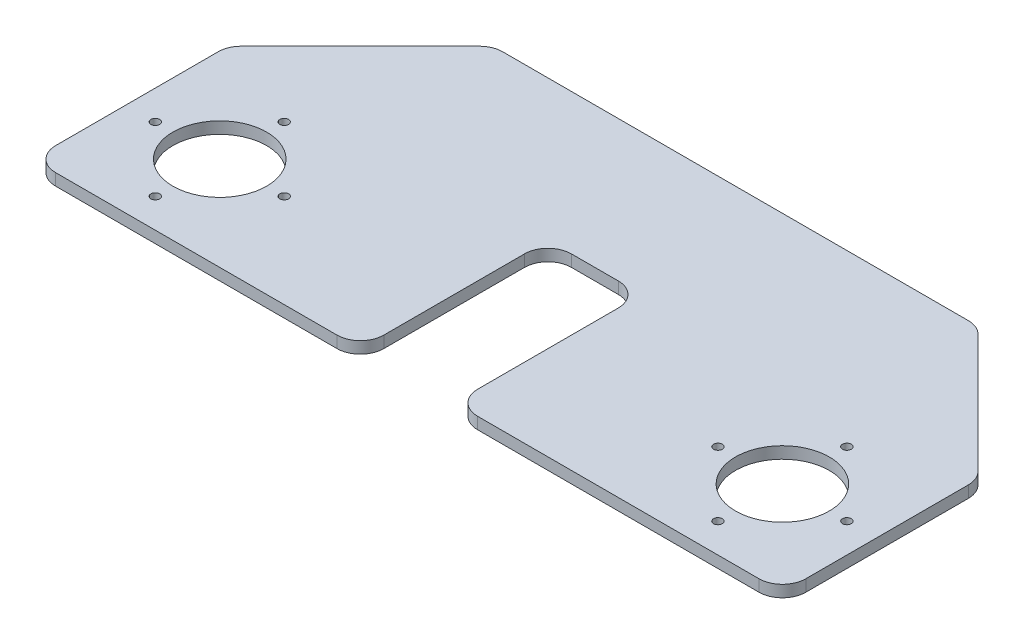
SolidWorks part; units mm, degrees
ref_plane "Front Plane" through (0, 0, 0) normal (0, 0, 1) x (1, 0, 0)
ref_plane "Top Plane" through (0, 0, 0) normal (0, 1, 0) x (1, 0, 0)
ref_plane "Right Plane" through (0, 0, 0) normal (1, 0, 0) x (0, 0, -1)
sketch "Sketch1" plane through (0, 0, 0) normal (0, 1, 0) x (1, 0, 0)
  line L0 (25.4, 50.8) -> (-25.4, -50.8) construction
  line L1 (-203.2, -50.8) -> (-25.4, -50.8)
  line L2 (-203.2, -50.8) -> (-203.2, 55.158)
  line L3 (-131.358, 127) -> (131.358, 127)
  line L4 (203.2, -50.8) -> (203.2, 55.158)
  line L5 (-131.358, 127) -> (-203.2, 55.158)
  line L6 (-25.4, -50.8) -> (-25.4, 50.8)
  line L7 (-25.4, 50.8) -> (25.4, 50.8)
  line L8 (25.4, -50.8) -> (25.4, 50.8)
  line L9 (25.4, -50.8) -> (203.2, -50.8)
  line L10 (131.358, 127) -> (203.2, 55.158)
  dimension "D1" = 406.4
  dimension "D2" = 203.2
  dimension "D3" = 177.8
  dimension "D4" = 127
  dimension "D5" = 50.8
  dimension "D6" = 101.6
  dimension "D7" = 101.6
  dimension "D8" = 135
  dimension "D9" = 45
extrude "Boss-Extrude1" add sketch "Sketch1" against normal blind 6.35
sketch "Sketch2" plane through (0, 0, 0) normal (0, 1, 0) x (1, 0, 0)
  circle A0 centre (-152.4, 0) radius 25.4
  circle A1 centre (152.4, 0) radius 25.4
  dimension "D1" = 50.8
  dimension "D2" = 50.8
  dimension "D3" = 152.4
  dimension "D4" = 152.4
extrude "Cut-Extrude1" cut sketch "Sketch2" against normal through all
sketch "Sketch3" plane through (0, 0, 0) normal (0, 1, 0) x (1, 0, 0)
  circle A0 centre (-152.4, 34.925) radius 2.3749
  circle A1 centre (-152.4, -34.925) radius 2.3749
  circle A2 centre (-117.475, 0) radius 2.3749
  circle A3 centre (-187.325, 0) radius 2.3749
  circle A4 centre (117.475, 0) radius 2.3749
  circle A5 centre (152.4, 34.925) radius 2.3749
  circle A6 centre (187.325, 0) radius 2.3749
  circle A7 centre (152.4, -34.925) radius 2.3749
  circle A8 centre (-152.4, 0) radius 25.4 construction
  circle A9 centre (152.4, 0) radius 25.4 construction
  dimension "D3" = 34.925
  dimension "D4" = 34.925
  dimension "D5" = 34.925
  dimension "D6" = 34.925
  dimension "D7" = 4.7498
  dimension "D8" = 4.7498
  dimension "D9" = 4.7498
  dimension "D10" = 4.7498
  dimension "D11" = 4.7498
  dimension "D12" = 4.7498
  dimension "D13" = 4.7498
  dimension "D14" = 4.7498
  dimension "D1" = 34.925
  dimension "D2" = 34.925
extrude "Cut-Extrude2" cut sketch "Sketch3" against normal blind 6.35
fillet "Fillet1" radius 12.7 10 edges at (-203.2, -3.175, 50.8) (-25.4, -3.175, -50.8) (25.4, -3.175, -50.8) (25.4, -3.175, 50.8) (-25.4, -3.175, 50.8) (203.2, -3.175, 50.8) (203.2, -3.175, -55.158) (131.358, -3.175, -127) (-131.358, -3.175, -127) (-203.2, -3.175, -55.158)
